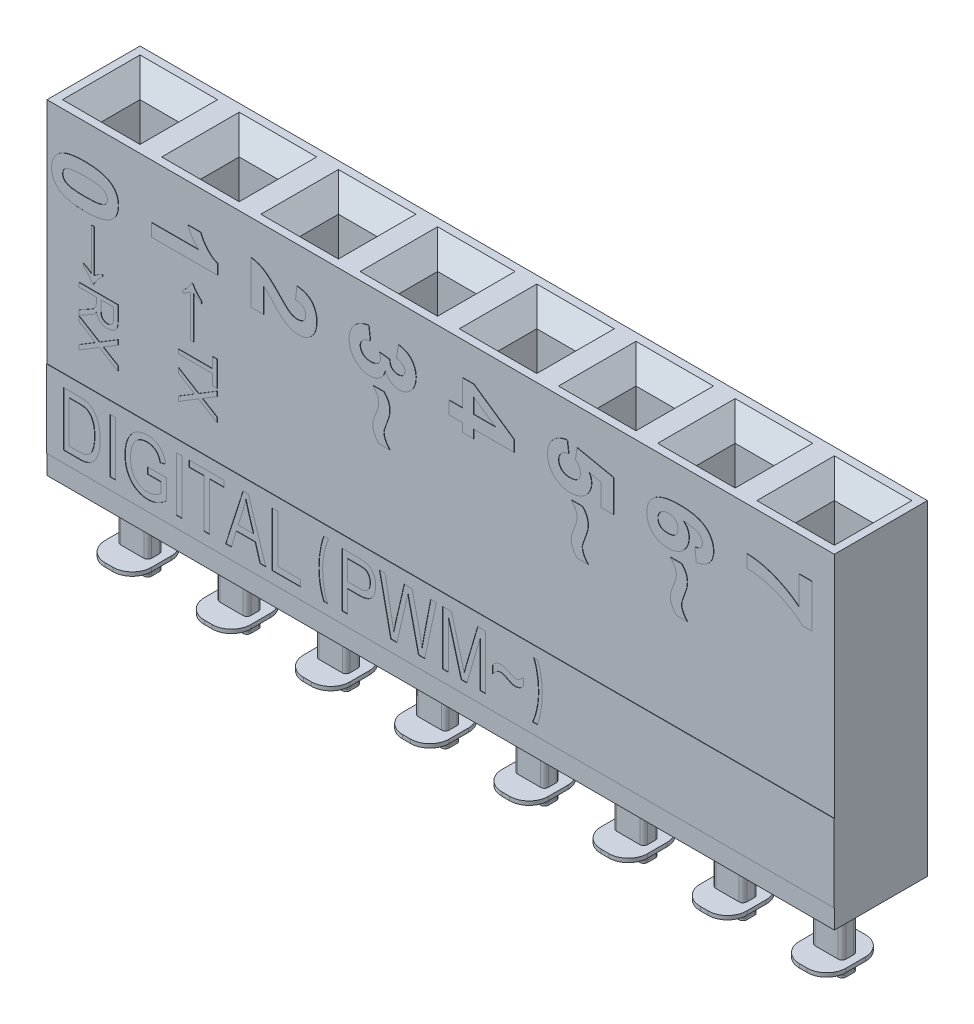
SolidWorks part; units mm, degrees
ref_plane "Plan de face" through (0, 0, 0) normal (0, 0, 1) x (1, 0, 0)
ref_plane "Plan de dessus" through (0, 0, 0) normal (0, 1, 0) x (1, 0, 0)
ref_plane "Plan de droite" through (0, 0, 0) normal (1, 0, 0) x (0, 0, -1)
sketch "Esquisse1" plane through (0, 0, 0) normal (0, 1, 0) x (1, 0, 0)
  line L1 (0, 0) -> (20.32, 0)
  line L2 (0, 0) -> (0, 2.4)
  line L3 (0, 2.4) -> (20.32, 2.4)
  line L4 (20.32, 0) -> (20.32, 2.4)
  dimension "D1" = 20.32
  dimension "D2" = 2.4
extrude "Boss.-Extru.1" add sketch "Esquisse1" along normal blind 8.4
sketch "Esquisse2" plane through (0, 8.4, 0) normal (0, 1, 0) x (1, 0, 0)
  line L0 (0, 0) -> (20.32, 0) construction
  line L1 (0.7, 0.7) -> (1.7, 0.7)
  line L2 (0.7, 0.7) -> (0.7, 1.7)
  line L3 (0.7, 1.7) -> (1.7, 1.7)
  line L4 (1.7, 0.7) -> (1.7, 1.7)
  line L5 (0, 2.4) -> (0, 0) construction
  dimension "D1" = 1
  dimension "D2" = 1
  dimension "D3" = 0.7
  dimension "D4" = 0.7
extrude "Enlèv. mat.-Extru.1" cut sketch "Esquisse2" against normal blind 2
chamfer "Chanfrein2" distance 0.5 angle 45 4 edges at (1.2, 8.4, -0.7) (1.7, 8.4, -1.2) (1.2, 8.4, -1.7) (0.7, 8.4, -1.2)
sketch "Esquisse3" plane through (0, 0, 0) normal (0, -1, 0) x (1, 0, 0)
  line L0 (20.32, -2.4) -> (0, -2.4) construction
  line L1 (0.8, -1) -> (1.6, -1)
  line L2 (0.8, -1) -> (0.8, -1.4)
  line L3 (0.8, -1.4) -> (1.6, -1.4)
  line L4 (1.6, -1) -> (1.6, -1.4)
  line L9 (0, -2.4) -> (0, 0) construction
  dimension "D1" = 0.4
  dimension "D2" = 0.8
  dimension "D7" = 0.8
  dimension "D8" = 1
extrude "Boss.-Extru.2" add sketch "Esquisse3" along normal blind 1.6
sketch "Esquisse5" plane through (0, -1.6, 0) normal (0, -1, 0) x (1, 0, 0)
  line L0 (0, -2.4) -> (0, 0) construction
  line L1 (1.1, -0.4) -> (1.3, -0.4)
  line L2 (0.6, -0.9) -> (0.6, -1.4)
  line L3 (1.1, -1.9) -> (1.3, -1.9)
  line L4 (1.8, -0.9) -> (1.8, -1.4)
  line L5 (20.32, -2.4) -> (0, -2.4) construction
  arc A0 (0.6, -1.4) -> (1.1, -1.9) centre (1.1, -1.4) ccw
  arc A1 (1.3, -1.9) -> (1.8, -1.4) centre (1.3, -1.4) ccw
  arc A2 (1.8, -0.9) -> (1.3, -0.4) centre (1.3, -0.9) ccw
  arc A3 (0.6, -0.9) -> (1.1, -0.4) centre (1.1, -0.9) cw
  point P10 (0.6, -1.9)
  point P15 (1.8, -0.4)
  point P18 (0.6, -0.4)
  dimension "D5" = 0.5
  dimension "D1" = 1.2
  dimension "D2" = 1.5
  dimension "D3" = 0.6
  dimension "D4" = 0.5
extrude "Boss.-Extru.3" add sketch "Esquisse5" along normal blind 0.1
sketch "Esquisse6" plane through (0, -1.7, 0) normal (0, -1, 0) x (1, 0, 0)
  line L1 (0.8, -1) -> (1.6, -1)
  line L2 (0.8, -1) -> (0.8, -1.4)
  line L3 (0.8, -1.4) -> (1.6, -1.4)
  line L4 (1.6, -1) -> (1.6, -1.4)
extrude "Boss.-Extru.4" add sketch "Esquisse6" along normal blind 0.3
fillet "Congé19" radius 0.1 4 edges at (0.8, -1.85, -1) (0.8, -1.85, -1.4) (1.6, -1.85, -1) (1.6, -1.85, -1.4)
fillet "Congé20" radius 0.1 4 edges at (0.8, -0.8, -1) (1.6, -0.8, -1) (1.6, -0.8, -1.4) (0.8, -0.8, -1.4)
fillet "Congé22" radius 0.25 7 edges at (1.5707, -1.7, -1.0293) (1.2, -1.7, -1) (0.8293, -1.7, -1.0293) (0.8, -1.7, -1.2) (1.5707, -1.7, -1.3707) (1.2, -1.7, -1.4) (0.8293, -1.7, -1.3707)
pattern_linear "Répétition linéaire1" count 8 spacing 2.56 along (1, 0, 0) of "Enlèv. mat.-Extru.1", "Chanfrein2"
pattern_linear "Répétition linéaire2" count 8 spacing 2.56 along (1, 0, 0) of "Boss.-Extru.2", "Boss.-Extru.3", "Boss.-Extru.4", "Congé20", "Congé19", "Congé22"
sketch "Esquisse7" plane through (0, 0, 0) normal (0, 0, 1) x (1, 0, 0)
  line L0 (0, 8.4) -> (0, 0) construction
  line L1 (0, 0.5) -> (20.32, 0.5)
  line L2 (0, 0.5) -> (0, 2.5)
  line L3 (0, 2.5) -> (20.32, 2.5)
  line L4 (20.32, 0.5) -> (20.32, 2.5)
  line L5 (20.32, 8.4) -> (20.32, 0) construction
  line L6 (0, 0) -> (20.32, 0) construction
  line L7 (18.07, 7.6) -> (18.07, 2.9824) construction
  line L8 (15.51, 7.6) -> (15.51, 2.9824) construction
  line L9 (12.95, 7.6) -> (12.95, 2.9824) construction
  line L10 (10.39, 7.6) -> (10.39, 2.9824) construction
  line L11 (0, 8.4) -> (20.32, 8.4) construction
  line L12 (7.83, 7.6) -> (7.83, 2.9824) construction
  line L13 (5.27, 7.6) -> (5.27, 2.9824) construction
  line L14 (2.71, 7.6) -> (2.71, 2.9824) construction
  line L15 (0.15, 7.6) -> (0.15, 2.9824) construction
  line L16 (3.3995, 6.2309) -> (3.3995, 2.9824) construction
  line L17 (0.8395, 6.2309) -> (0.8395, 2.9824) construction
  text T0 "7" font "Arial" height 1.7
  text T1 "6~" font "Arial" height 1.7
  text T2 "5~" font "Arial" height 1.7
  text T3 "4" font "Arial" height 1.7
  text T4 "3~" font "Arial" height 1.7
  text T5 "2" font "Arial" height 1.7
  text T6 "1" font "Arial" height 1.7
  text T7 "0" font "Arial" height 1.7
  text T8 "←TX" font "Arial Narrow" height 1
  text T9 "→RX" font "Arial Narrow" height 1
  dimension "D1" = 0.5
  dimension "D2" = 2
  dimension "D3" = 2.25
  dimension "D4" = 2.56
  dimension "D5" = 2.56
  dimension "D6" = 2.56
  dimension "D7" = 0.8
  dimension "D8" = 2.56
  dimension "D9" = 2.56
  dimension "D10" = 2.56
  dimension "D11" = 2.56
  dimension "D12" = 2.56
extrude "Boss.-Extru.5" add sketch "Esquisse7" along normal blind 0.01
sketch "Esquisse8" plane through (0, 0, 0.01) normal (0, 0, 1) x (1, 0, 0)
  line L0 (0.3105, 0.7908) -> (16.7191, 0.7908) construction
  text T0 "DIGITAL  PWM~" font "Arial Narrow" height 1.4
extrude "Enlèv. mat.-Extru.3" cut sketch "Esquisse8" against normal blind 0.01
sketch "Esquisse9" plane through (0, 0, 0.01) normal (0, 0, 1) x (1, 0, 0)
  line L0 (6.8409, 1.079) -> (13.5646, 1.079) construction
  text T0 "(            )" font "Century Gothic" height 1.1
extrude "Enlèv. mat.-Extru.4" cut sketch "Esquisse9" against normal blind 0.01
